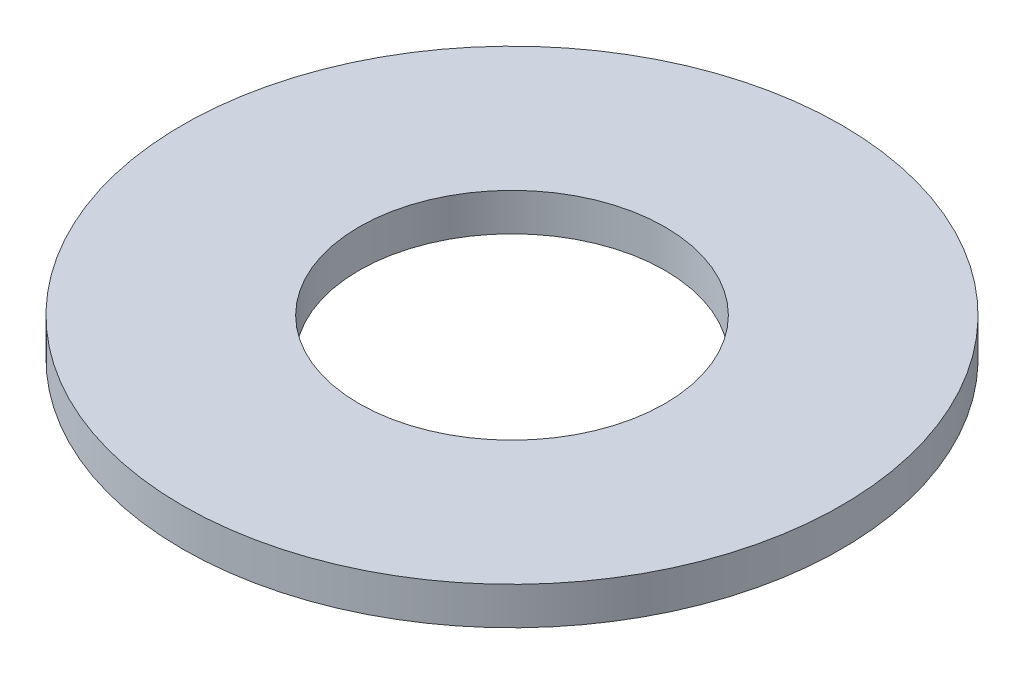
SolidWorks part; units mm, degrees
ref_plane "Front" through (0, 0, 0) normal (0, 0, 1) x (1, 0, 0)
ref_plane "Top" through (0, 0, 0) normal (0, 1, 0) x (1, 0, 0)
ref_plane "Right" through (0, 0, 0) normal (1, 0, 0) x (0, 0, -1)
sketch "Sketch1" plane through (0, 0, 0) normal (0, 1, 0) x (1, 0, 0)
  circle A0 centre (0, 0) radius 11.1125
  circle A1 centre (0, 0) radius 5.1594
  dimension "D1" = 22.225
  dimension "D2" = 10.3187
extrude "Extrude1" add sketch "Sketch1" along normal blind 1.27
